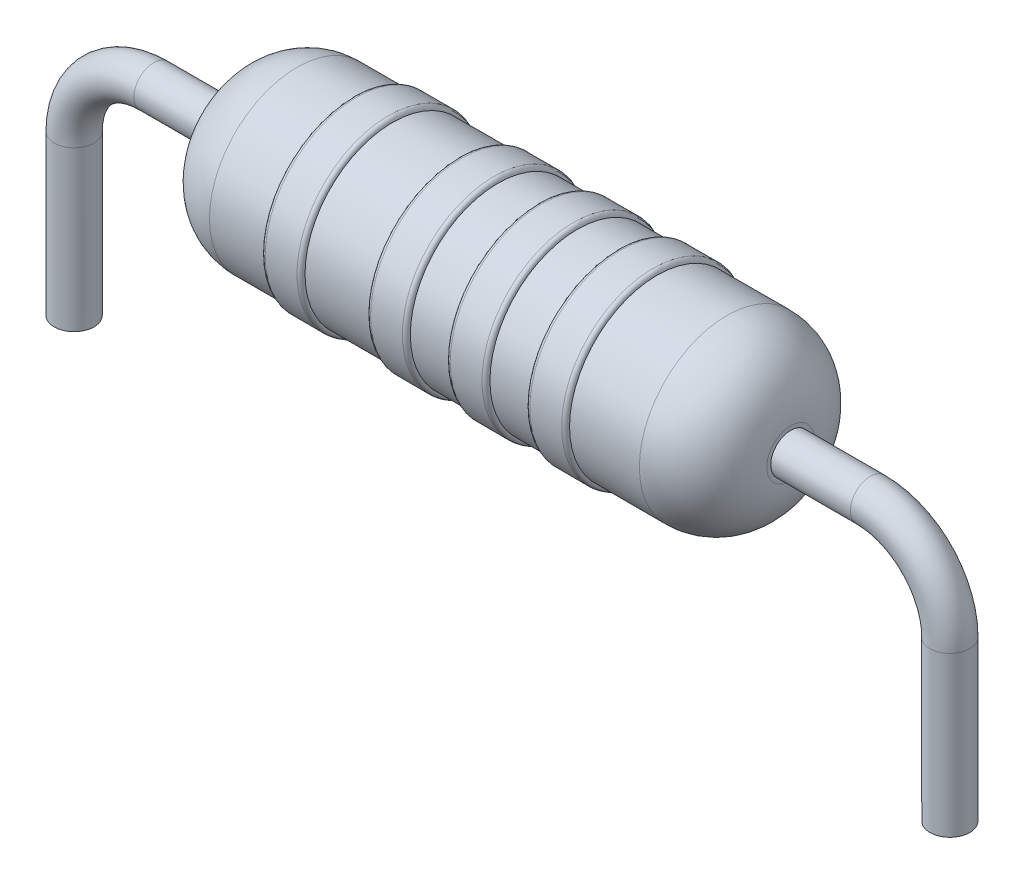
SolidWorks part; units mm, degrees
ref_plane "Face" through (0, 0, 0) normal (0, 0, 1) x (1, 0, 0)
ref_plane "Dessus" through (0, 0, 0) normal (0, 1, 0) x (1, 0, 0)
ref_plane "Droite" through (0, 0, 0) normal (1, 0, 0) x (0, 0, -1)
sketch "Esquisse1" plane through (0, 0, 0) normal (0, 0, 1) x (1, 0, 0)
  line L0 (-54.2687, 0) -> (62.1733, 0) construction
  line L1 (-48.4922, 1.1) -> (45.7559, 1.1) construction
  line L2 (-3.5, -1.6411) -> (-3.5, 4.3175) construction
  line L3 (0, -1.0268) -> (0, 4.1947) construction
  line L4 (3.5, 3.6009) -> (3.5, -1.9687) construction
  line L5 (-3.5, 0) -> (-3.5, 0.3)
  line L6 (-2.7, 1.1) -> (2.7, 1.1)
  line L7 (3.5, 0.3) -> (3.5, 0)
  line L8 (3.5, 0) -> (-3.5, 0)
  arc A0 (-2.7, 1.1) -> (-3.5, 0.3) centre (-2.7, 0.3) ccw
  arc A1 (3.5, 0.3) -> (2.7, 1.1) centre (2.7, 0.3) ccw
revolve "Base-Révolution" add sketch "Esquisse1" angle 360 about L0
sketch "Esquisse2" plane through (0, 0, 0) normal (0, 0, 1) x (1, 0, 0)
  line L0 (-3.3896, 1.15) -> (3.161, 1.15) construction
  line L1 (-2, 1.3889) -> (-2, -0.1179) construction
  line L2 (-1.5, 1.4925) -> (-1.5, -0.2136) construction
  line L3 (4.3262, 0) -> (-3.8651, 0) construction
  line L4 (1.323, 0) -> (1.823, 0)
  line L5 (0.323, 0) -> (0.823, 0)
  line L6 (-0.677, 1.15) -> (-0.677, 0)
  line L7 (0.323, 1.15) -> (0.323, 0)
  line L8 (1.323, 1.15) -> (1.323, 0)
  line L9 (-0.177, 1.15) -> (-0.177, 0)
  line L10 (0.823, 1.15) -> (0.823, 0)
  line L11 (1.823, 1.15) -> (1.823, 0)
  line L12 (-0.677, 0) -> (-0.177, 0)
  line L13 (-0.677, 1.15) -> (-0.177, 1.15)
  line L14 (0.323, 1.15) -> (0.823, 1.15)
  line L15 (1.323, 1.15) -> (1.823, 1.15)
  line L16 (-2, 1.15) -> (-1.5, 1.15)
  line L17 (-1.5, 1.15) -> (-1.5, 0)
  line L18 (-1.5, 0) -> (-2, 0)
  line L19 (-2, 0) -> (-2, 1.15)
revolve "Boss.-Révol.1" add sketch "Esquisse2" angle 360 about L3
fillet "Congé1" radius 0.05 8 edges at (-0.177, 0, -1.15) (-0.677, 0, -1.15) (0.823, 0, -1.15) (0.323, 0, -1.15) (1.823, 0, -1.15) (1.323, 0, -1.15) (-1.5, 0, -1.15) (-2, 0, -1.15)
sketch "Esquisse3" plane through (-3.5, 0, 0) normal (-1, 0, 0) x (0, 0, 1)
  circle A0 centre (0, 0) radius 0.25
sketch "Esquisse4" plane through (0, 0, 0) normal (0, 0, 1) x (1, 0, 0)
  line L0 (-3.1075, 0) -> (-5.8186, 0) construction
  line L1 (0, -2.524) -> (0, 3.2043) construction
  line L2 (-5.9326, -3) -> (3.6667, -3) construction
  line L3 (-5.5, 1.6795) -> (-5.5, -3.4934) construction
  line L4 (-3.5, 0) -> (-4.5, 0)
  line L5 (-5.5, -3) -> (-5.5, -1)
  arc A0 (-4.5, 0) -> (-5.5, -1) centre (-4.5, -1) ccw
  dimension "D3" = 1
  dimension "D1" = 3
  dimension "D2" = 5.5
sweep "Balayage1" add profiles "Esquisse3" path "Esquisse4"
ref_plane "Plan1" through (0, 0, 0) normal (1, 0, 0) x (0, 0, -1)
mirror "Symétrie1" about plane through (0, 0, 0) normal (1, 0, 0) of "Balayage1"
